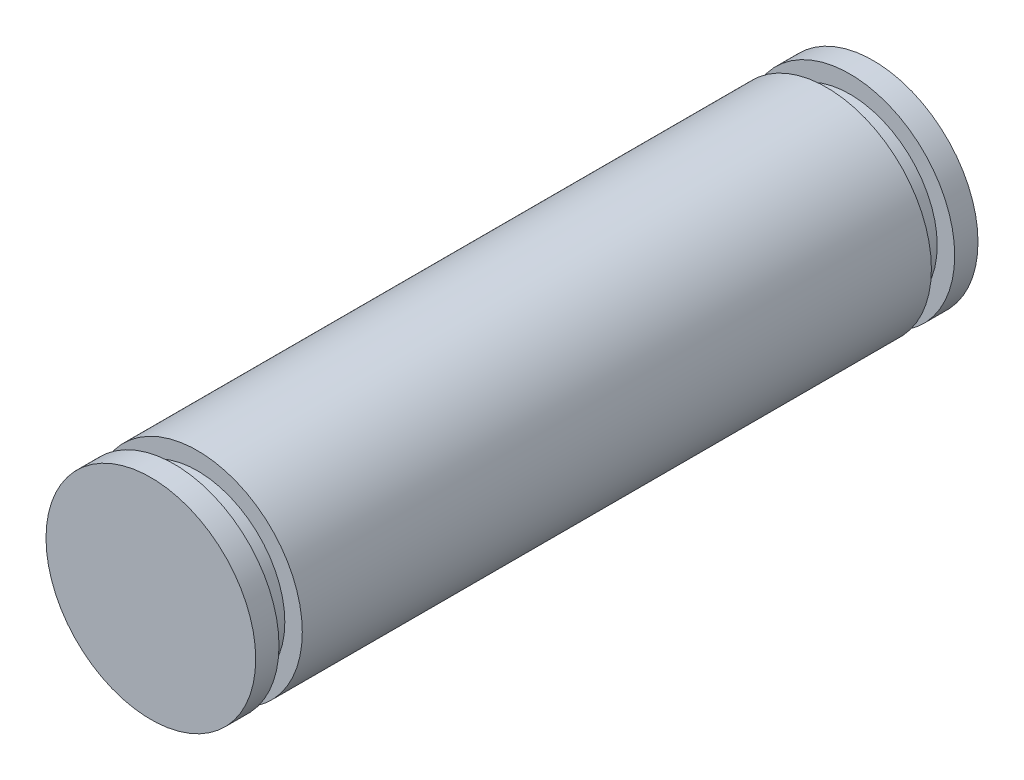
SolidWorks part; units mm, degrees
ref_plane "Plan de face" through (0, 0, 0) normal (0, 0, 1) x (1, 0, 0)
ref_plane "Plan de dessus" through (0, 0, 0) normal (0, 1, 0) x (1, 0, 0)
ref_plane "Plan de droite" through (0, 0, 0) normal (1, 0, 0) x (0, 0, -1)
sketch "Esquisse1" plane through (0, 0, 0) normal (0, 0, 1) x (1, 0, 0)
  circle A0 centre (0, 0) radius 4.5
  dimension "D1" = 9
extrude "Extrusion1" add sketch "Esquisse1" along normal blind 1
sketch "Esquisse2" plane through (0, 0, 1) normal (0, 0, 1) x (1, 0, 0)
  circle A0 centre (0, 0) radius 3.75
  dimension "D1" = 7.5
extrude "Extrusion2" add sketch "Esquisse2" along normal blind 1
sketch "Esquisse3" plane through (0, 0, 2) normal (0, 0, 1) x (1, 0, 0)
  circle A0 centre (0, 0) radius 4.5
extrude "Extrusion3" add sketch "Esquisse3" along normal blind 27
sketch "Esquisse4" plane through (0, 0, 29) normal (0, 0, 1) x (1, 0, 0)
  circle A0 centre (0, 0) radius 3.75
  dimension "D1" = 7.5
extrude "Extrusion4" add sketch "Esquisse4" along normal blind 1
sketch "Esquisse5" plane through (0, 0, 30) normal (0, 0, 1) x (1, 0, 0)
  circle A0 centre (0, 0) radius 4.5
extrude "Extrusion5" add sketch "Esquisse5" along normal blind 1
